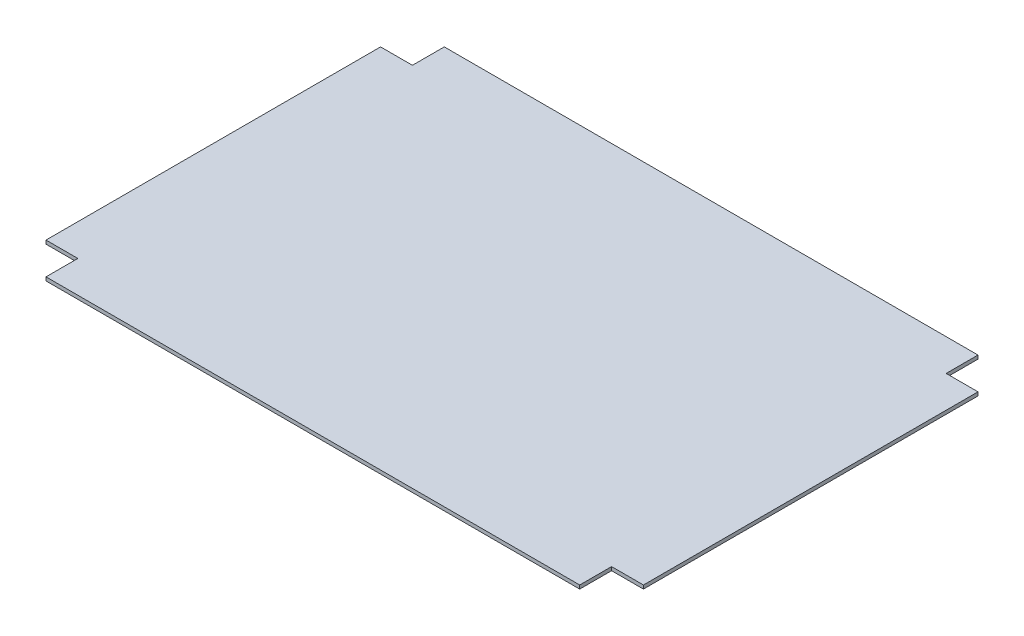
SolidWorks part; units mm, degrees
ref_plane "Front Plane" through (0, 0, 0) normal (0, 0, 1) x (1, 0, 0)
ref_plane "Top Plane" through (0, 0, 0) normal (0, 1, 0) x (1, 0, 0)
ref_plane "Right Plane" through (0, 0, 0) normal (1, 0, 0) x (0, 0, -1)
sketch "Sketch1" plane through (0, 0, 0) normal (0, 1, 0) x (1, 0, 0)
  line L0 (-670, 455) -> (-750, 455)
  line L1 (-670, -465) -> (670, -465)
  line L2 (-750, -385) -> (-750, 535)
  line L3 (-750, 535) -> (670, 535)
  line L4 (750, -385) -> (750, 455)
  line L5 (-670, -438.8028) -> (670, 438.8028) construction
  line L6 (-750, 535) -> (670, -477.9333) construction
  line L7 (-670, 455) -> (-670, 535)
  line L8 (-750, -385) -> (-670, -385)
  line L9 (-670, -385) -> (-670, -465)
  line L10 (670, -465) -> (670, -385)
  line L11 (670, -385) -> (750, -385)
  line L12 (670, 535) -> (670, 455)
  line L13 (670, 455) -> (750, 455)
  point P0 (0, 0)
  dimension "D1" = 80
  dimension "D2" = 80
  dimension "D3" = 80
  dimension "D4" = 80
  dimension "D5" = 80
  dimension "D6" = 80
  dimension "D7" = 80
  dimension "D8" = 80
  dimension "D9" = 1500
  dimension "D10" = 1000
extrude "Boss-Extrude1" add sketch "Sketch1" along normal blind 9 contours L13 L12 L3 L7 L0 L2 L8 L9 L1 L10 L11 L4
